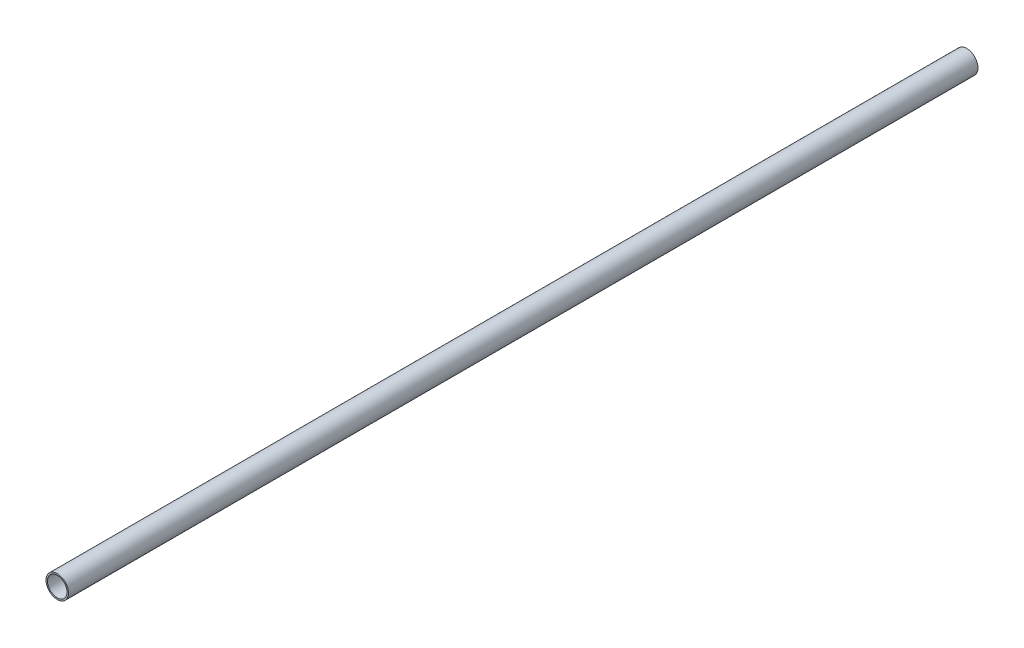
SolidWorks part; units mm, degrees
ref_plane "Front Plane" through (0, 0, 0) normal (0, 0, 1) x (1, 0, 0)
ref_plane "Top Plane" through (0, 0, 0) normal (0, 1, 0) x (1, 0, 0)
ref_plane "Right Plane" through (0, 0, 0) normal (1, 0, 0) x (0, 0, -1)
sketch "Sketch1" plane through (0, 0, 0) normal (0, 0, 1) x (1, 0, 0)
  circle A0 centre (0, 0) radius 30.1625
  circle A1 centre (0, 0) radius 26.2509
  dimension "D1" = 60.325
  dimension "D2" = 52.5018
extrude "Extrude1" add sketch "Sketch1" along normal blind 2438.4
